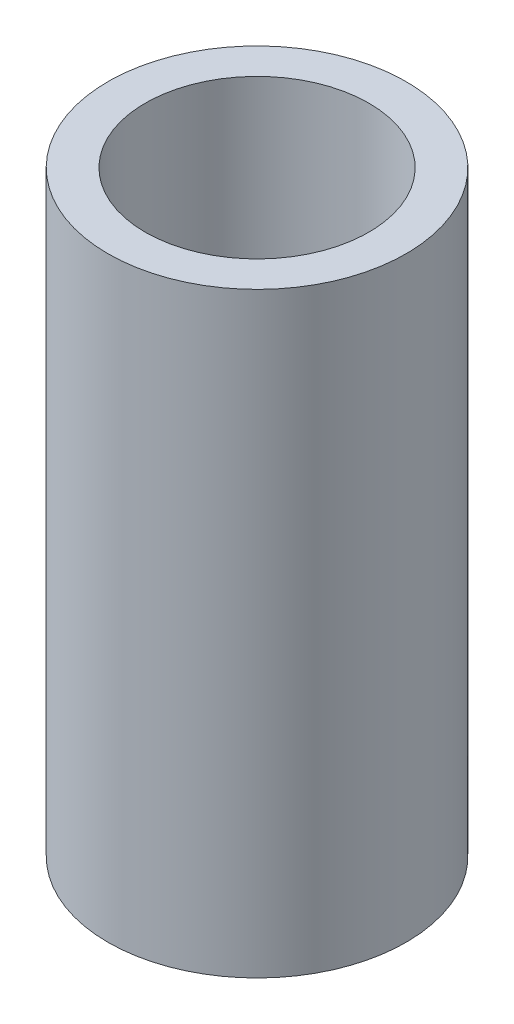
SolidWorks part; units mm, degrees
ref_plane "Front Plane" through (0, 0, 0) normal (0, 0, 1) x (1, 0, 0)
ref_plane "Top Plane" through (0, 0, 0) normal (0, 1, 0) x (1, 0, 0)
ref_plane "Right Plane" through (0, 0, 0) normal (1, 0, 0) x (0, 0, -1)
sketch "Sketch1" plane through (0, 0, 0) normal (0, 1, 0) x (1, 0, 0)
  circle A0 centre (0, 0) radius 4.7625
  circle A1 centre (0, 0) radius 6.35
  dimension "D1" = 9.525
  dimension "D2" = 1.5875
sketch "Sketch2" plane through (0, 0, 0) normal (0, 0, 1) x (1, 0, 0)
  line L0 (0, 0) -> (0, 25.4)
  dimension "D1" = 25.4
sweep "Sweep1" add profiles "Sketch1" path "Sketch2"
